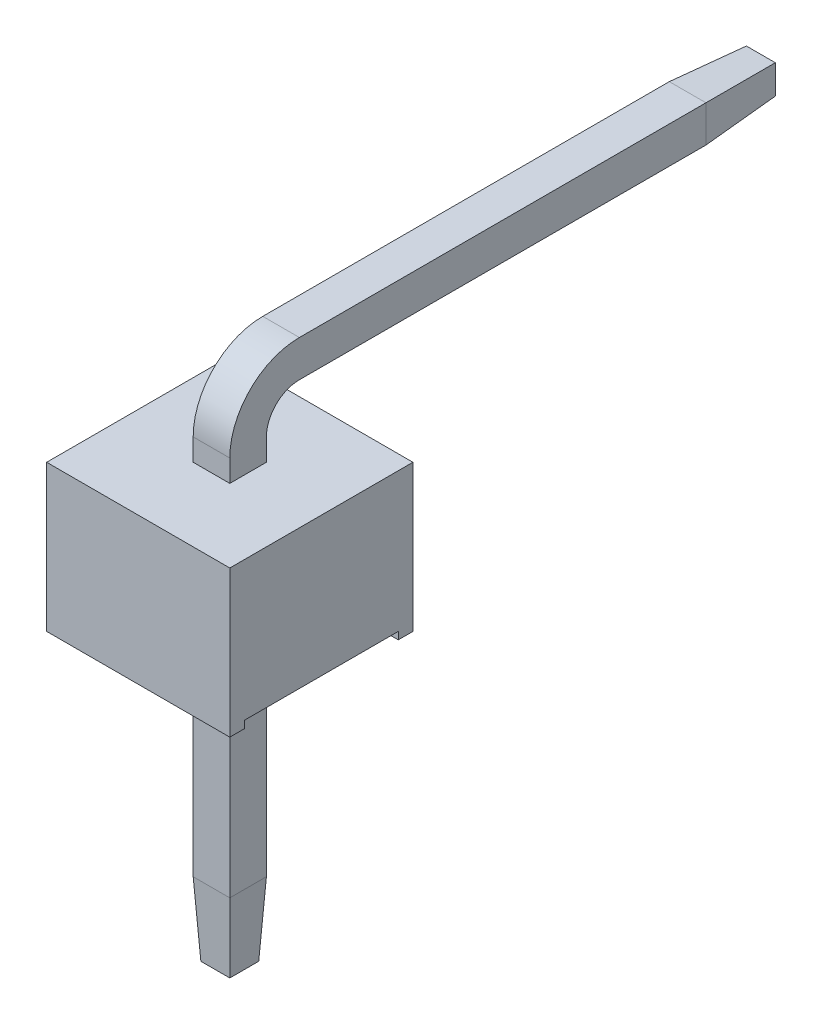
SolidWorks part; units mm, degrees
ref_plane "Alzado" through (0, 0, 0) normal (0, 0, 1) x (1, 0, 0)
ref_plane "Planta" through (0, 0, 0) normal (0, 1, 0) x (1, 0, 0)
ref_plane "Vista lateral" through (0, 0, 0) normal (1, 0, 0) x (0, 0, -1)
sketch "Croquis1" plane through (0, 0, 0) normal (0, 1, 0) x (1, 0, 0)
  line L1 (-1.25, -1.25) -> (1.25, -1.25)
  line L2 (-1.25, -1.25) -> (-1.25, 1.25)
  line L3 (-1.25, 1.25) -> (1.25, 1.25)
  line L4 (1.25, -1.25) -> (1.25, 1.25)
  line L5 (-1.25, -1.25) -> (1.25, 1.25) construction
  line L6 (-1.25, 1.25) -> (1.25, -1.25) construction
  point P0 (0, 0)
  dimension "D1" = 2.5
extrude "Saliente-Extruir1" add sketch "Croquis1" along normal blind 2
sketch "Croquis2" plane through (0, 0, 0) normal (0, -1, 0) x (1, 0, 0)
  line L0 (1.25, 1.25) -> (1.25, -1.25) construction
  line L1 (-1.25, -1.05) -> (1.25, -1.05)
  line L2 (-1.25, -1.05) -> (-1.25, 1.05)
  line L3 (-1.25, 1.05) -> (1.25, 1.05)
  line L4 (1.25, -1.05) -> (1.25, 1.05)
  line L5 (-1.25, -1.05) -> (1.25, 1.05) construction
  line L6 (-1.25, 1.05) -> (1.25, -1.05) construction
  line L7 (-1.25, 1.25) -> (1.25, 1.25) construction
  point P0 (0, 0)
  dimension "D1" = 0.2
extrude "Cortar-Extruir1" cut sketch "Croquis2" against normal blind 0.1
sketch "Croquis3" plane through (0, 0.1, 0) normal (0, -1, 0) x (1, 0, 0)
  line L1 (-0.25, -0.25) -> (0.25, -0.25)
  line L2 (-0.25, -0.25) -> (-0.25, 0.25)
  line L3 (-0.25, 0.25) -> (0.25, 0.25)
  line L4 (0.25, -0.25) -> (0.25, 0.25)
  line L5 (-0.25, -0.25) -> (0.25, 0.25) construction
  line L6 (-0.25, 0.25) -> (0.25, -0.25) construction
  point P0 (0, 0)
  dimension "D1" = 0.5
extrude "Saliente-Extruir2" add sketch "Croquis3" along normal blind 4
ref_plane "Plano1" through (0, -2.9, 0) normal (0, -1, 0) x (-1, 0, 0)
sketch "Croquis5" plane through (0, -2.9, 0) normal (0, -1, 0) x (-1, 0, 0)
  line L4 (-0.25, 0.25) -> (-0.25, -0.25)
  line L5 (-0.25, -0.25) -> (0.25, -0.25)
  line L6 (0.25, -0.25) -> (0.25, 0.25)
  line L7 (0.25, 0.25) -> (-0.25, 0.25)
  line L8 (-0.25, 0.25) -> (-0.25, -0.25)
  line L9 (-0.25, -0.25) -> (0.25, -0.25)
  line L10 (0.25, -0.25) -> (0.25, 0.25)
  line L11 (0.25, 0.25) -> (-0.25, 0.25)
  dimension "D1" = 0
extrude "Cortar-Extruir2" cut sketch "Croquis5" along normal blind 1 draft 3 flip side to cut
sketch "Croquis6" plane through (0, 2, 0) normal (0, 1, 0) x (1, 0, 0)
  line L0 (-0.25, 0.25) -> (0.25, 0.25) construction
  line L1 (-0.25, -0.25) -> (-0.25, 0.25) construction
  line L2 (0.25, 0.25) -> (0.25, -0.25) construction
  line L3 (0.25, -0.25) -> (-0.25, -0.25) construction
  line L4 (-0.25, 0.25) -> (0.25, 0.25)
  line L5 (-0.25, -0.25) -> (-0.25, 0.25)
  line L6 (0.25, 0.25) -> (0.25, -0.25)
  line L7 (0.25, -0.25) -> (-0.25, -0.25)
ref_plane "Plano2" through (0, 0, 0) normal (1, 0, 0) x (0, 0, -1)
sketch "Croquis7" plane through (0, 0, 0) normal (1, 0, 0) x (0, 0, -1)
  line L0 (0, 2) -> (0, 2.3)
  line L1 (-0.25, 2) -> (0.25, 2) construction
  line L2 (0.7, 3) -> (7.25, 3)
  line L3 (1.25, 2) -> (1.25, 0) construction
  arc A0 (0.7, 3) -> (0, 2.3) centre (0.7, 2.3) ccw
  dimension "D2" = 0.7
  dimension "D1" = 6
sweep "Barrer1" add profiles "Croquis6" path "Croquis7"
ref_plane "Plano3" through (0, 0, -6.25) normal (0, 0, -1) x (-1, 0, 0)
sketch "Croquis8" plane through (0, 0, -6.25) normal (0, 0, -1) x (-1, 0, 0)
  line L4 (0.25, 2.75) -> (0.25, 3.25)
  line L5 (0.25, 3.25) -> (-0.25, 3.25)
  line L6 (-0.25, 3.25) -> (-0.25, 2.75)
  line L7 (-0.25, 2.75) -> (0.25, 2.75)
  line L8 (0.25, 2.75) -> (0.25, 3.25)
  line L9 (0.25, 3.25) -> (-0.25, 3.25)
  line L10 (-0.25, 3.25) -> (-0.25, 2.75)
  line L11 (-0.25, 2.75) -> (0.25, 2.75)
  dimension "D1" = 0
extrude "Cortar-Extruir3" cut sketch "Croquis8" along normal blind 1 draft 3 flip side to cut
